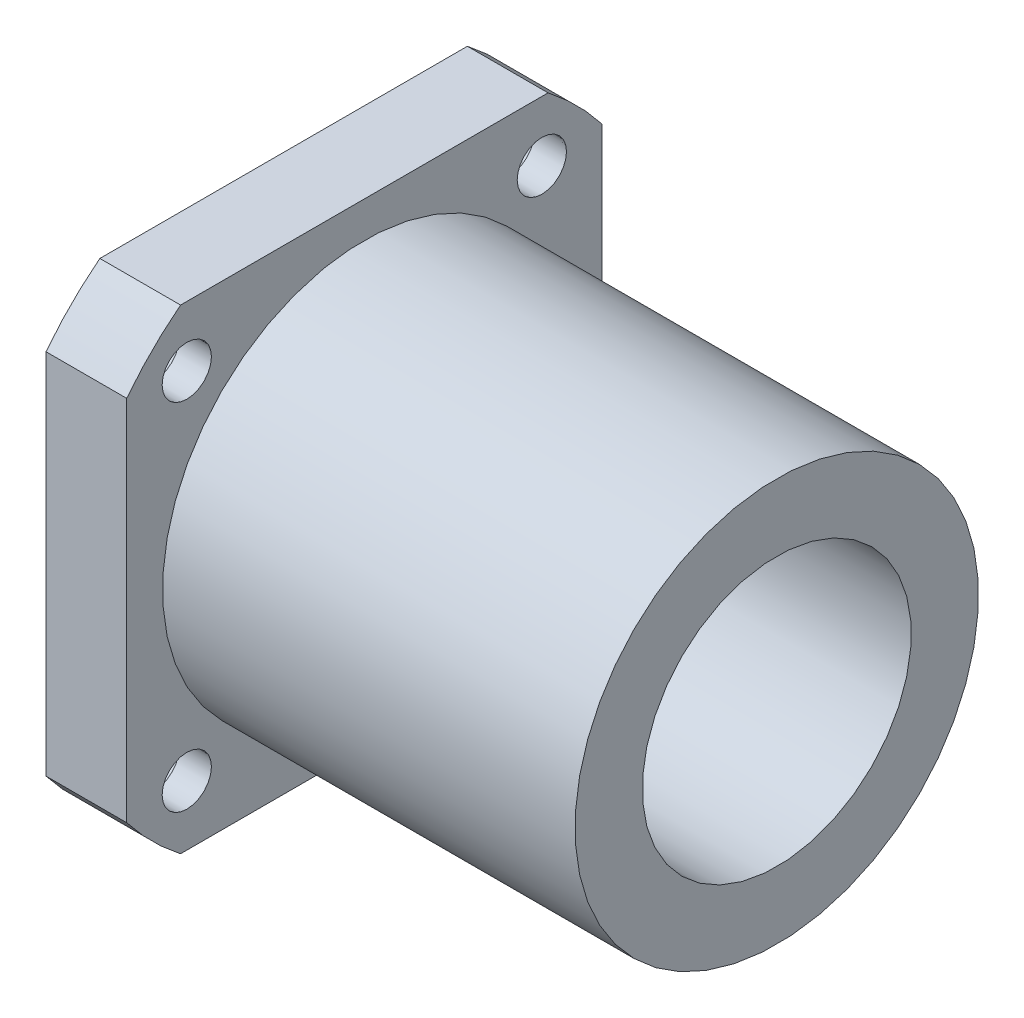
SolidWorks part; units mm, degrees
other "Solid1"
ref_plane "Front Plane" through (0, 0, 0) normal (0, 0, 1) x (1, 0, 0)
ref_plane "Top Plane" through (0, 0, 0) normal (0, 1, 0) x (1, 0, 0)
ref_plane "Right Plane" through (0, 0, 0) normal (1, 0, 0) x (0, 0, -1)
imported_body "2.7056 LMK60UU.stp<1>"
move or copy body "Body-Move/Copy1" bodies to move or copy 101 copy no rotation origin (0, 0, 0) rotation axis (1, 0, 0) rotation angle 45
